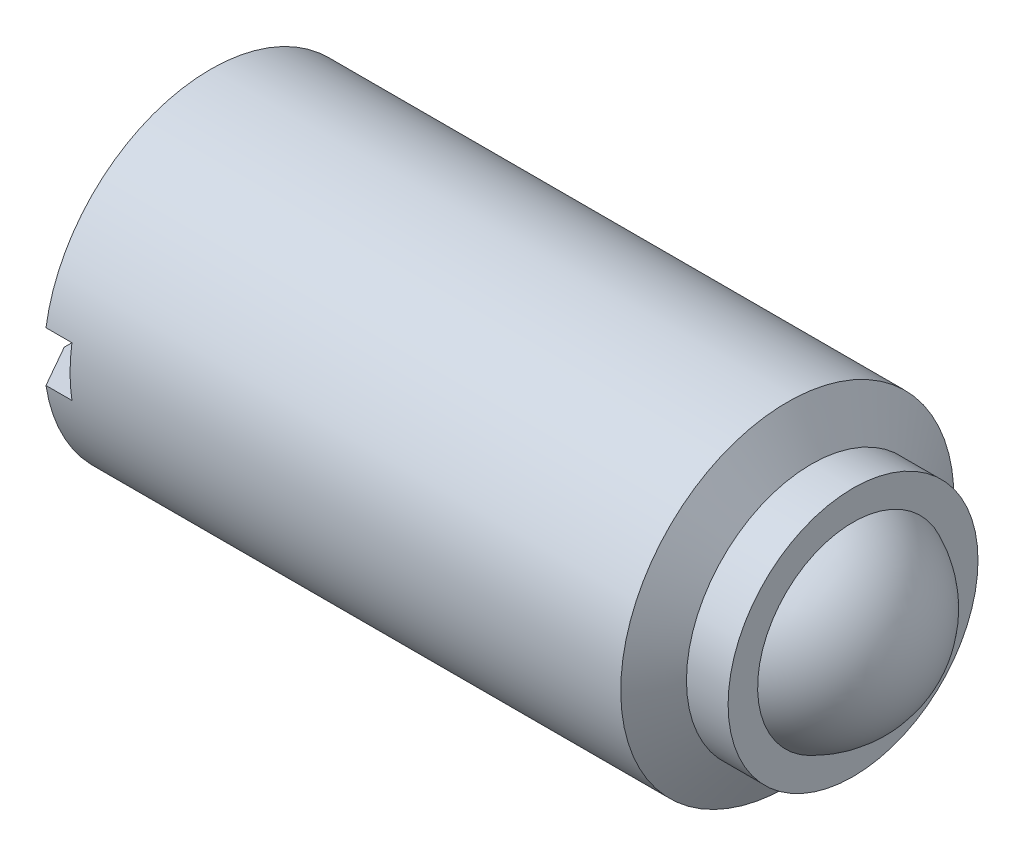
SolidWorks part; units mm, degrees
ref_plane "Plan1" through (0, 0, 0) normal (0, 0, 1) x (1, 0, 0)
ref_plane "Plan2" through (0, 0, 0) normal (0, 1, 0) x (1, 0, 0)
ref_plane "Plan3" through (0, 0, 0) normal (1, 0, 0) x (0, 0, -1)
sketch "Esquisse1" plane through (0, 0, 0) normal (0, 0, 1) x (1, 0, 0)
  line L0 (-23.955, 0) -> (84.2405, 0) construction
  line L1 (55, 0) -> (-55, 0) construction
  line L2 (0, 0) -> (0, 3)
  line L3 (0, 3) -> (0.5774, 4)
  line L4 (0.5774, 4) -> (14.4226, 4)
  line L5 (14.4226, 4) -> (15, 3)
  line L6 (15, 3) -> (16, 3)
  line L7 (16, 3) -> (16, 2.2913)
  line L8 (0, -55) -> (0, 55) construction
  line L9 (17.5, 0) -> (0, 0)
  arc A0 (16, 2.2913) -> (17.5, 0) centre (15, 0) cw
  dimension "D1" = 30
  dimension "D6" = 2.5
  dimension "D2" = 1
  dimension "D3" = 30
  dimension "D4" = 8
  dimension "D5" = 1
  dimension "D7" = 1.5
  dimension "D8" = 16
revolve "Révolution1" add sketch "Esquisse1" angle 360 about L0
sketch "Esquisse2" plane through (0, 0, 0) normal (0, 0, 1) x (1, 0, 0)
  line L1 (1.2, 0.6) -> (0, 0.6)
  line L2 (1.2, 0.6) -> (1.2, -0.6)
  line L3 (1.2, -0.6) -> (0, -0.6)
  line L4 (0, 0.6) -> (0, -0.6)
  dimension "D1" = 1.2
extrude "Enlèv. mat.-Extru.1" cut sketch "Esquisse2" against normal through all and the other way through all
